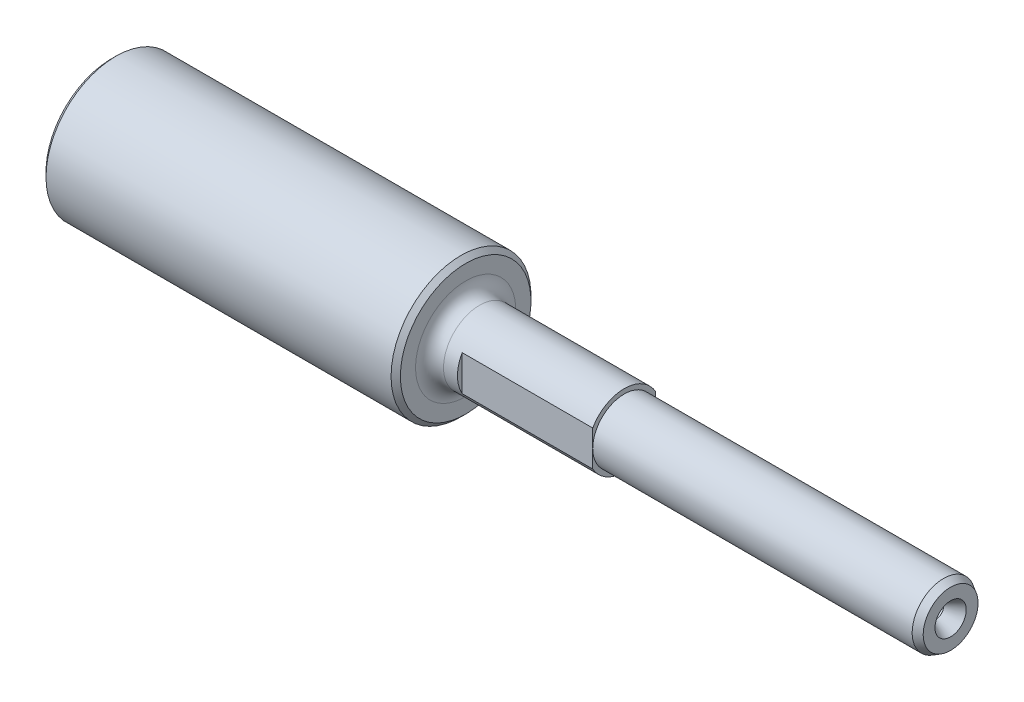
SolidWorks part; units mm, degrees
ref_plane "Plan de face" through (0, 0, 0) normal (0, 0, 1) x (1, 0, 0)
ref_plane "Plan de dessus" through (0, 0, 0) normal (0, 1, 0) x (1, 0, 0)
ref_plane "Plan de droite" through (0, 0, 0) normal (1, 0, 0) x (0, 0, -1)
sketch "Esquisse1" plane through (0, 0, 0) normal (0, 0, 1) x (1, 0, 0)
  line L0 (0, 0) -> (85.1663, 0) construction
  line L1 (0, 6.75) -> (0, 7.75)
  line L2 (70, 0) -> (-110, 0)
  line L4 (0, 6.75) -> (70, 6.75)
  line L5 (70, 0) -> (70, 6.75)
  line L6 (0, 7.75) -> (-34, 7.75)
  line L7 (-34, 7.75) -> (-34, 15)
  line L8 (-34, 15) -> (-110, 15)
  line L9 (-110, 15) -> (-110, 0)
  dimension "D1" = 13.5
  dimension "D2" = 70
  dimension "D3" = 30
  dimension "D4" = 180
  dimension "D5" = 76
  dimension "D6" = 15.5
revolve "Révolution1" add sketch "Esquisse1" angle 360 about L0
chamfer "Chanfrein1" distance 1.5 angle 30 1 edges at (70, 0, 6.75)
fillet "Congé1" radius 3 1 edges at (-34, 0, 7.75)
chamfer "Chanfrein2" distance 1 angle 45 2 edges at (-34, 0, 15) (-110, 0, 15)
sketch "Esquisse2" plane through (0, 0, 0) normal (1, 0, 0) x (0, 0, -1)
  line L0 (-6.75, 3.8079) -> (-6.75, -3.8079)
  line L1 (6.75, 3.8079) -> (6.75, -3.8079)
  circle A0 centre (0, 0) radius 7.75 construction
  arc A1 (-6.75, 3.8079) -> (-6.75, -3.8079) centre (0, 0) ccw
  circle A2 centre (0, 0) radius 6.75 construction
  circle A3 centre (0, 0) radius 6.75 construction
  arc A4 (6.75, -3.8079) -> (6.75, 3.8079) centre (0, 0) ccw
extrude "Enlèv. mat.-Extru.1" cut sketch "Esquisse2" against normal blind 28
hole_wizard "Fraisage pour vis à tête fraisée à 6 pans creux M101" positions "Esquisse4" profile "Esquisse3" countersink size "M10" standard "ISO"
sketch "Esquisse4" plane through (70, 0, 0) normal (1, 0, 0) x (0, 0, -1)
  point P0 (0, 0)
sketch "Esquisse3" plane through (70, 0, 0) normal (0, 1, 0) x (0, 0, -1)
  line L0 (0, 0) -> (0, 7.9464)
  line L1 (0, 7.9464) -> (1.575, 7)
  line L2 (1.575, 7) -> (1.575, 3.0744)
  line L3 (1.575, 3.0744) -> (3.35, 0)
  line L5 (3.35, 0) -> (0, 0)
  line L6 (-1.575, 3.0744) -> (-3.35, 0) construction
  line L10 (0, 7.9464) -> (-1.575, 7) construction
  line L11 (0, -6.35) -> (0, 107.95) construction
  dimension "Diamètre du perçage" = 3.15
  dimension "Profondeur du perçage" = 7
  dimension "Diamètre du fraisage entrant" = 6.7
  dimension "Angle du fraisage entrant" = 60
  dimension "Angle de pointe" = 118
